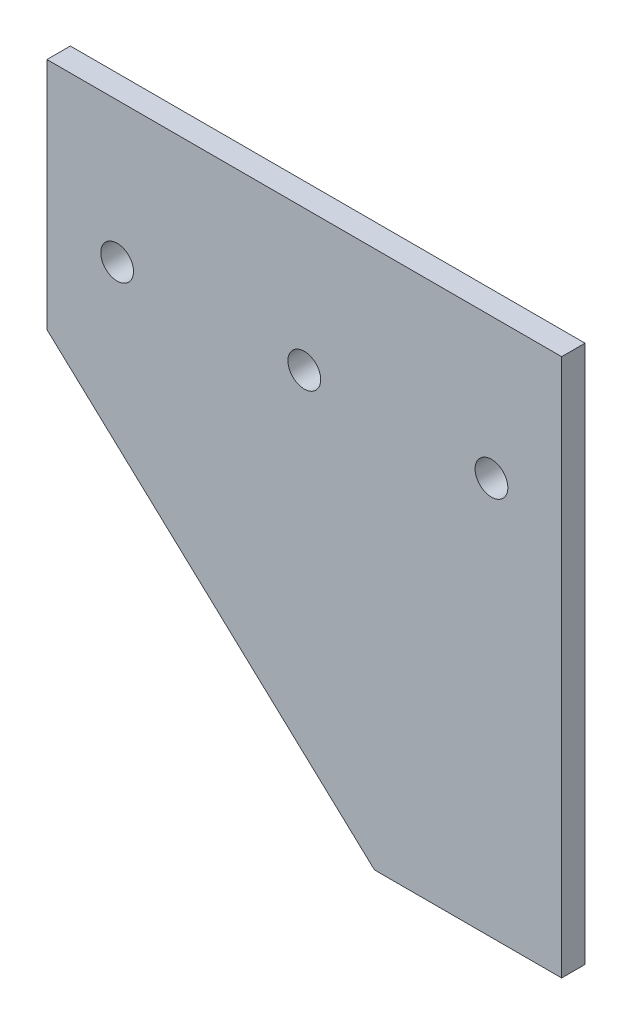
SolidWorks part; units mm, degrees
ref_plane "Face" through (0, 0, 0) normal (0, 0, 1) x (1, 0, 0)
ref_plane "Dessus" through (0, 0, 0) normal (0, 1, 0) x (1, 0, 0)
ref_plane "Droite" through (0, 0, 0) normal (1, 0, 0) x (0, 0, -1)
sketch "Esquisse1" plane through (0, 0, 0) normal (0, 0, 1) x (1, 0, 0)
  line L0 (-110, 15) -> (30, -115)
  line L1 (-110, 115) -> (110, 115)
  line L2 (-110, 115) -> (-110, 15)
  line L3 (30, -115) -> (110, -115)
  line L4 (110, 115) -> (110, -115)
  circle A1 centre (-80, 55) radius 7
  circle A3 centre (0, 55) radius 7
  circle A5 centre (80, 55) radius 7
  dimension "D5" = 100
  dimension "D6" = 80
  dimension "D7" = 30
  dimension "D8" = 60
  dimension "D14" = 14
  dimension "D16" = 14
  dimension "D9" = 60
  dimension "D10" = 60
  dimension "D11" = 80
  dimension "D13" = 14
  dimension "D1" = 220
  dimension "D2" = 110
  dimension "D3" = 230
  dimension "D4" = 115
  dimension "D12" = 80
extrude "Extrusion1" add sketch "Esquisse1" along normal blind 10
